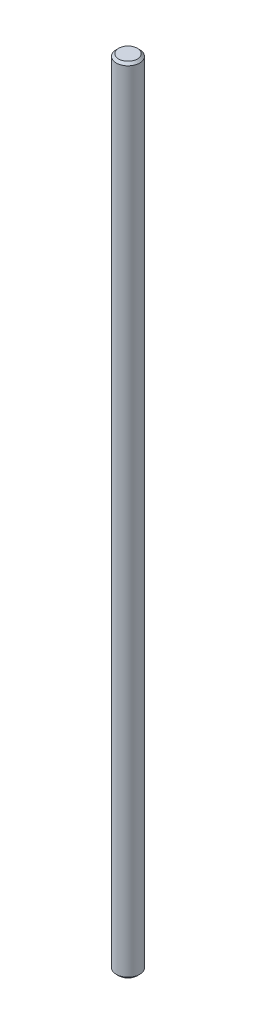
SolidWorks part; units mm, degrees
ref_plane "Front Plane" through (0, 0, 0) normal (0, 0, 1) x (1, 0, 0)
ref_plane "Top Plane" through (0, 0, 0) normal (0, 1, 0) x (1, 0, 0)
ref_plane "Right Plane" through (0, 0, 0) normal (1, 0, 0) x (0, 0, -1)
sketch "Sketch1" plane through (0, 0, 0) normal (0, 1, 0) x (1, 0, 0)
  circle A0 centre (0, 0) radius 2
  dimension "D1" = 4
extrude "Extrude1" add sketch "Sketch1" along normal blind 136
chamfer "Chamfer1" distance 0.4 angle 45 2 edges at (0, 0, 2) (0, 136, 2)
